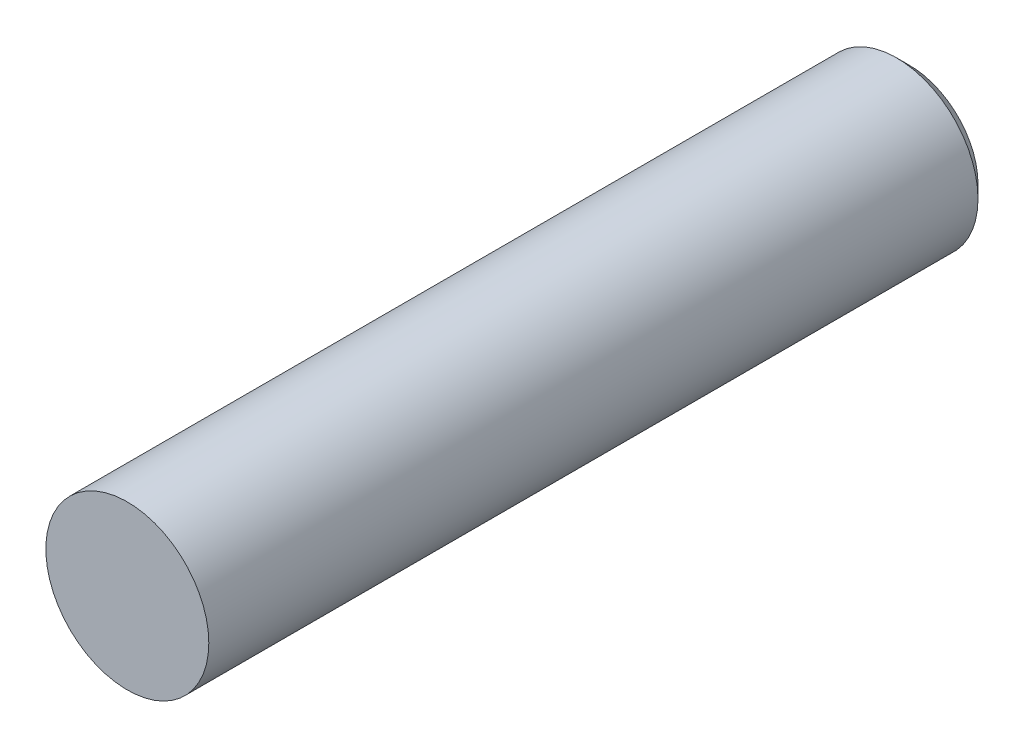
SolidWorks part; units mm, degrees
ref_plane "Face" through (0, 0, 0) normal (0, 0, 1) x (1, 0, 0)
ref_plane "Dessus" through (0, 0, 0) normal (0, 1, 0) x (1, 0, 0)
ref_plane "Droite" through (0, 0, 0) normal (1, 0, 0) x (0, 0, -1)
sketch "Esquisse1" plane through (0, 0, 0) normal (0, 0, 1) x (1, 0, 0)
  circle A0 centre (0, 0) radius 12.5
  dimension "D1" = 25
extrude "Base-Extrusion" add sketch "Esquisse1" along normal blind 120
chamfer "Chanfrein1" distance 2 angle 45
